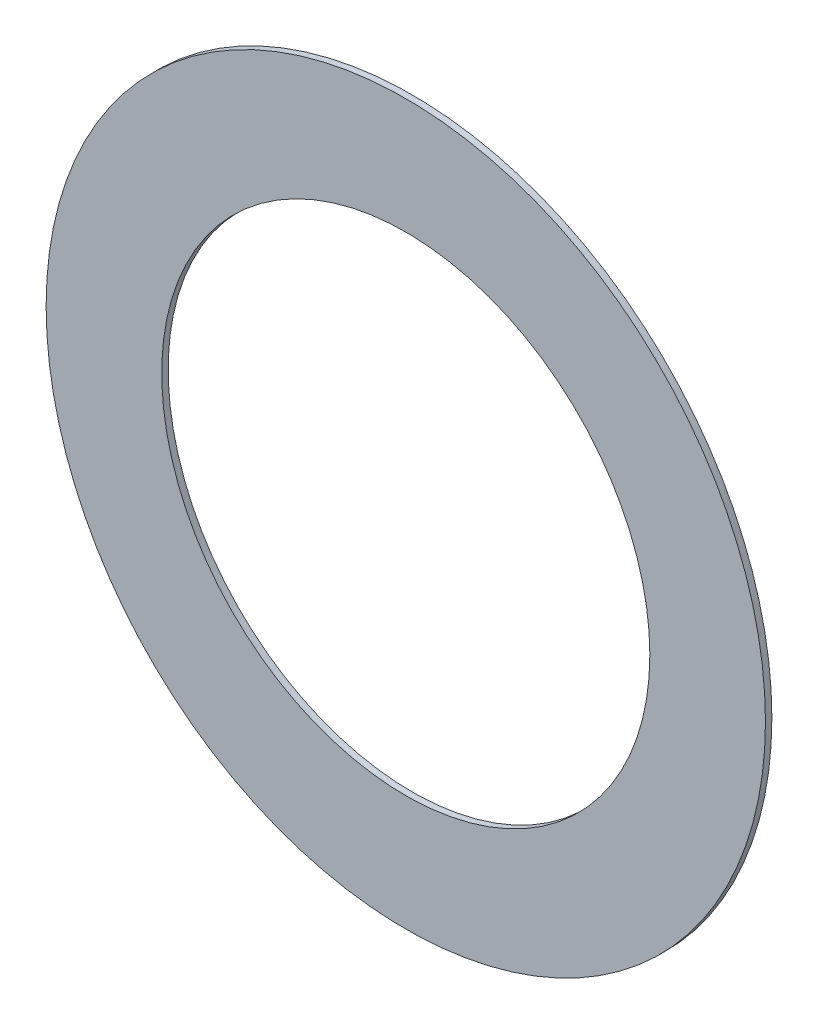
SolidWorks part; units mm, degrees
ref_plane "Plan1" through (0, 0, 0) normal (0, 0, 1) x (1, 0, 0)
ref_plane "Plan2" through (0, 0, 0) normal (0, 1, 0) x (1, 0, 0)
ref_plane "Plan3" through (0, 0, 0) normal (1, 0, 0) x (0, 0, -1)
sketch "Esquisse1" plane through (0, 0, 0) normal (1, 0, 0) x (0, 0, -1)
  line L0 (0.125, 9.5) -> (-0.125, 9.5)
  line L1 (0.125, 9.5) -> (0.125, 14)
  line L2 (-0.125, 14) -> (0.125, 14)
  line L3 (-0.125, 14) -> (-0.125, 9.5)
  line L4 (0, 0) -> (8, 0) construction
  dimension "D1" = 0.25
  dimension "D2" = 9.5
  dimension "D3" = 14
  dimension "D4" = 0.125
revolve "Base-Révolution" add sketch "Esquisse1" angle 360 about L4
